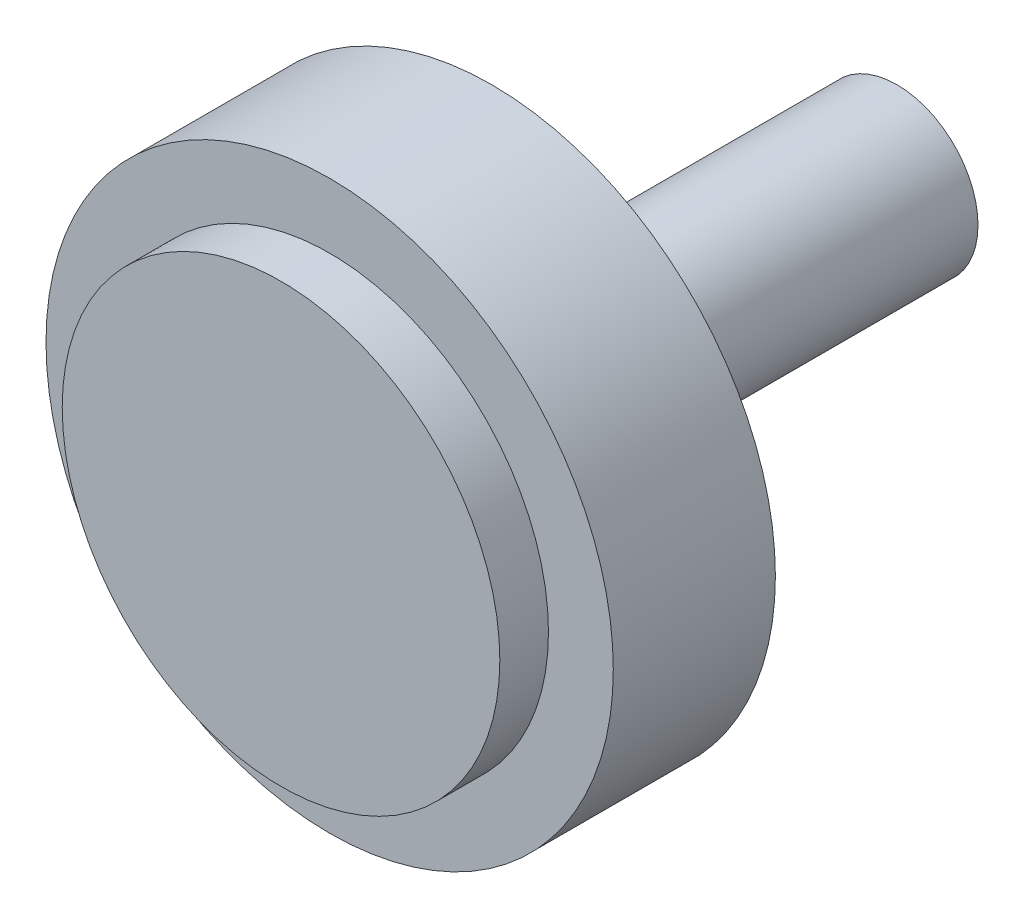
SolidWorks part; units mm, degrees
ref_plane "Plan de face" through (0, 0, 0) normal (0, 0, 1) x (1, 0, 0)
ref_plane "Plan de dessus" through (0, 0, 0) normal (0, 1, 0) x (1, 0, 0)
ref_plane "Plan de droite" through (0, 0, 0) normal (1, 0, 0) x (0, 0, -1)
sketch "Esquisse1" plane through (0, 0, 0) normal (0, 0, 1) x (1, 0, 0)
  circle A0 centre (0, 0) radius 17.5
  dimension "D1" = 35
extrude "Extrusion1" add sketch "Esquisse1" along normal blind 10
sketch "Esquisse2" plane through (0, 0, 10) normal (0, 0, 1) x (1, 0, 0)
  circle A0 centre (0, 0) radius 13.5
  dimension "D1" = 27
extrude "Extrusion2" add sketch "Esquisse2" along normal blind 3
sketch "Esquisse3" plane through (0, 0, 0) normal (0, 0, -1) x (-1, 0, 0)
  circle A0 centre (0, 0) radius 5
  dimension "D1" = 10
extrude "Extrusion3" add sketch "Esquisse3" along normal blind 25
